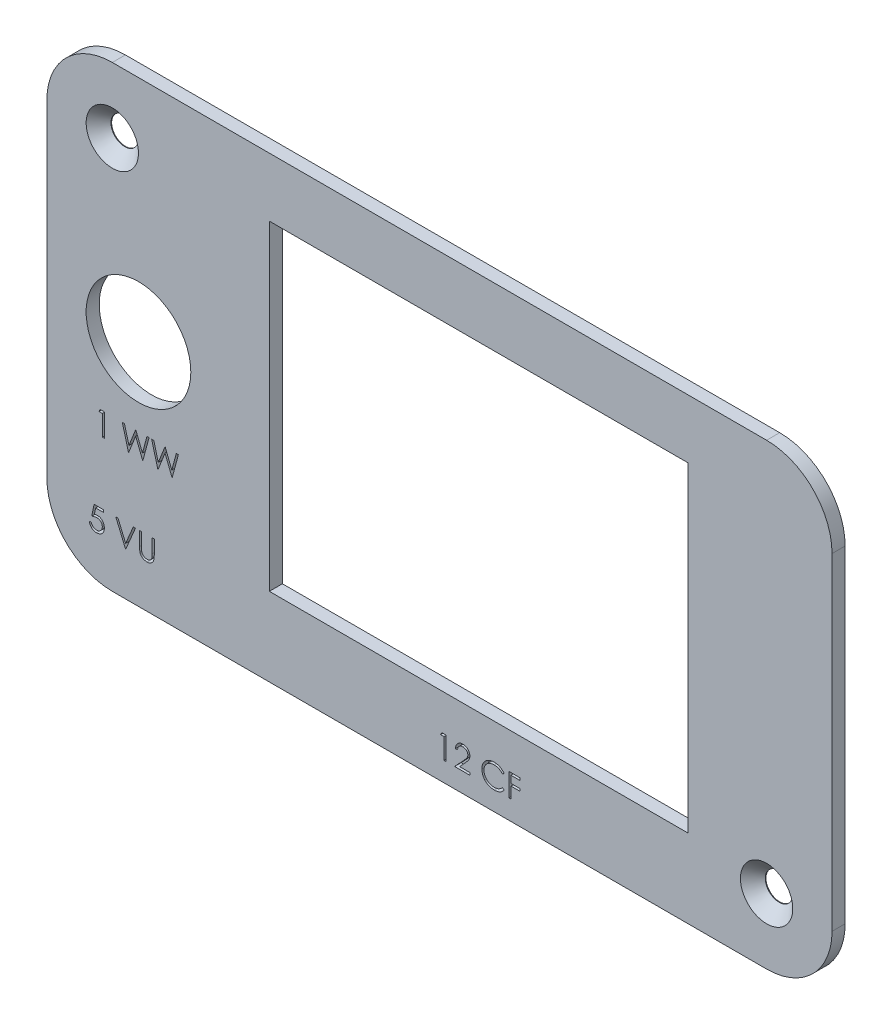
SolidWorks part; units mm, degrees
ref_plane "Plan de face" through (0, 0, 0) normal (0, 0, 1) x (1, 0, 0)
ref_plane "Plan de dessus" through (0, 0, 0) normal (0, 1, 0) x (1, 0, 0)
ref_plane "Plan de droite" through (0, 0, 0) normal (1, 0, 0) x (0, 0, -1)
sketch "Esquisse1" plane through (0, 0, 0) normal (0, 0, 1) x (1, 0, 0)
  line L1 (0, 0) -> (120, 0)
  line L2 (0, 0) -> (0, 70)
  line L3 (0, 70) -> (120, 70)
  line L4 (120, 0) -> (120, 70)
  dimension "D1" = 120
  dimension "D2" = 70
extrude "Boss.-Extru.1" add sketch "Esquisse1" along normal blind 2
fillet "Congé1" radius 10 4 edges at (120, 0, 1) (0, 0, 1) (0, 70, 1) (120, 70, 1)
sketch "Esquisse2" plane through (0, 0, 2) normal (0, 0, 1) x (1, 0, 0)
  line L0 (0, 60) -> (0, 10) construction
  line L1 (110, 70) -> (10, 70) construction
  line L2 (120, 10) -> (120, 60) construction
  line L3 (10, 0) -> (110, 0) construction
  circle A0 centre (10, 60) radius 2.1
  circle A1 centre (110, 10) radius 2.1
  dimension "D1" = 10
  dimension "D5" = 4.2
  dimension "D6" = 4.2
  dimension "D2" = 10
  dimension "D3" = 10
  dimension "D4" = 10
extrude "Enlèv. mat.-Extru.1" cut sketch "Esquisse2" against normal through all
sketch "Esquisse3" plane through (0, 0, 2) normal (0, 0, 1) x (1, 0, 0)
  line L0 (10, 0) -> (110, 0) construction
  line L1 (34, 61) -> (98, 61)
  line L2 (34, 61) -> (34, 12)
  line L3 (34, 12) -> (98, 12)
  line L4 (98, 61) -> (98, 12)
  line L5 (120, 10) -> (120, 60) construction
  line L6 (110, 70) -> (10, 70) construction
  circle A2 centre (14, 35) radius 8
  dimension "D6" = 16
  dimension "D1" = 49
  dimension "D2" = 64
  dimension "D3" = 20
  dimension "4" = 12
  dimension "D7" = 22
  dimension "D13" = 35
extrude "Enlèv. mat.-Extru.3" cut sketch "Esquisse3" against normal through all
chamfer "Chanfrein1" distance 1.9 angle 45 2 edges at (112.1, 10, 2) (12.1, 60, 2)
sketch "Esquisse4" plane through (0, 0, 2) normal (0, 0, 1) x (1, 0, 0)
  text T0 "5 VU  "
  text T1 "12 CF"
  text T2 "1 WW"
extrude "Enlèv. mat.-Extru.4" cut sketch "Esquisse4" against normal blind 1
